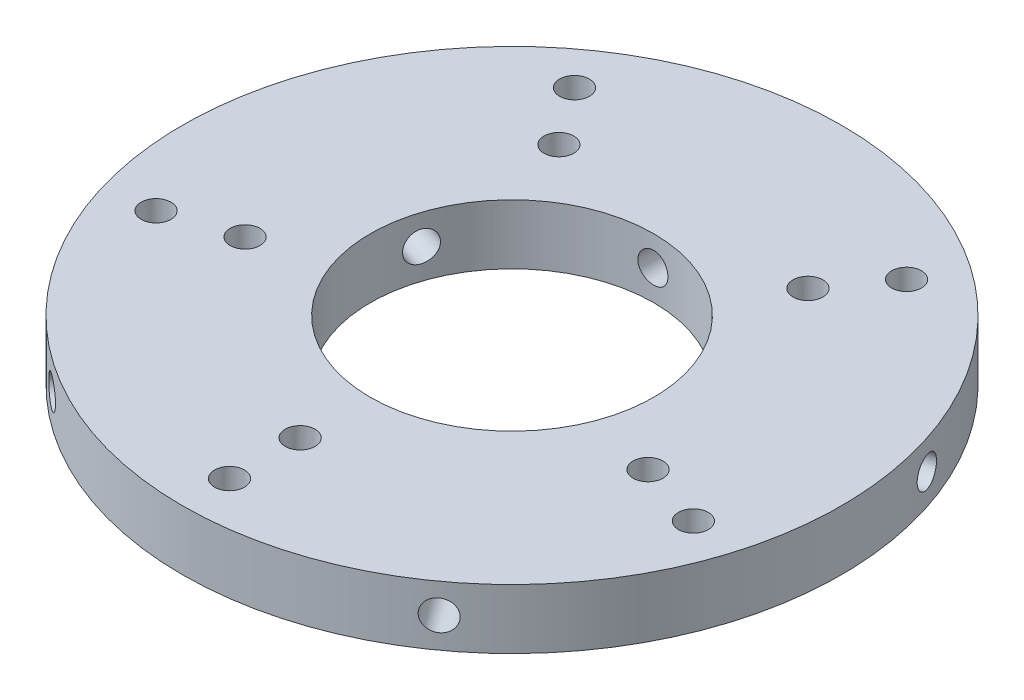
SolidWorks part; units mm, degrees
ref_plane "Alzado" through (0, 0, 0) normal (0, 0, 1) x (1, 0, 0)
ref_plane "Planta" through (0, 0, 0) normal (0, 1, 0) x (1, 0, 0)
ref_plane "Vista lateral" through (0, 0, 0) normal (1, 0, 0) x (0, 0, -1)
sketch "Croquis1" plane through (0, 0, 0) normal (0, 1, 0) x (1, 0, 0)
  circle A0 centre (0, 0) radius 30.1
  circle A1 centre (0, 0) radius 70
extrude "Extruir1" add sketch "Croquis1" along normal blind 12.7
sketch "Croquis2" plane through (0, 0, 0) normal (0, 0, 1) x (1, 0, 0)
  line L0 (0, -6.985) -> (0, 6.985) construction
  circle A0 centre (0, 6.4288) radius 3.2
extrude "Cortar-Extruir1" cut sketch "Croquis2" against normal up to next
sketch "Croquis3" plane through (0, 0, 0) normal (0, 0, 1) x (1, 0, 0)
  line L0 (0, 0) -> (0, 13.55)
ref_axis "Eje1" through (0, 13.55, 0) along (0, -1, 0)
pattern_circular "MatrizC1" count 5 over 360 about axis through (0, 13.55, 0) along (0, -1, 0) of "Cortar-Extruir1"
sketch "Croquis4" plane through (0, 12.7, 0) normal (0, 1, 0) x (-1, 0, 0)
  line L0 (0, 7.4525) -> (0, -7.4525) construction
  circle A0 centre (0, 60) radius 3.175
  circle A1 centre (0, 45) radius 3.175
  circle A3 centre (0, 0) radius 70 construction
  dimension "D1" = 15
  dimension "D2" = 10
extrude "Cortar-Extruir2" cut sketch "Croquis4" against normal up to next
pattern_circular "MatrizC2" count 5 over 360 about axis through (0, 0, 0) along (0, 1, 0) of "Cortar-Extruir2"
